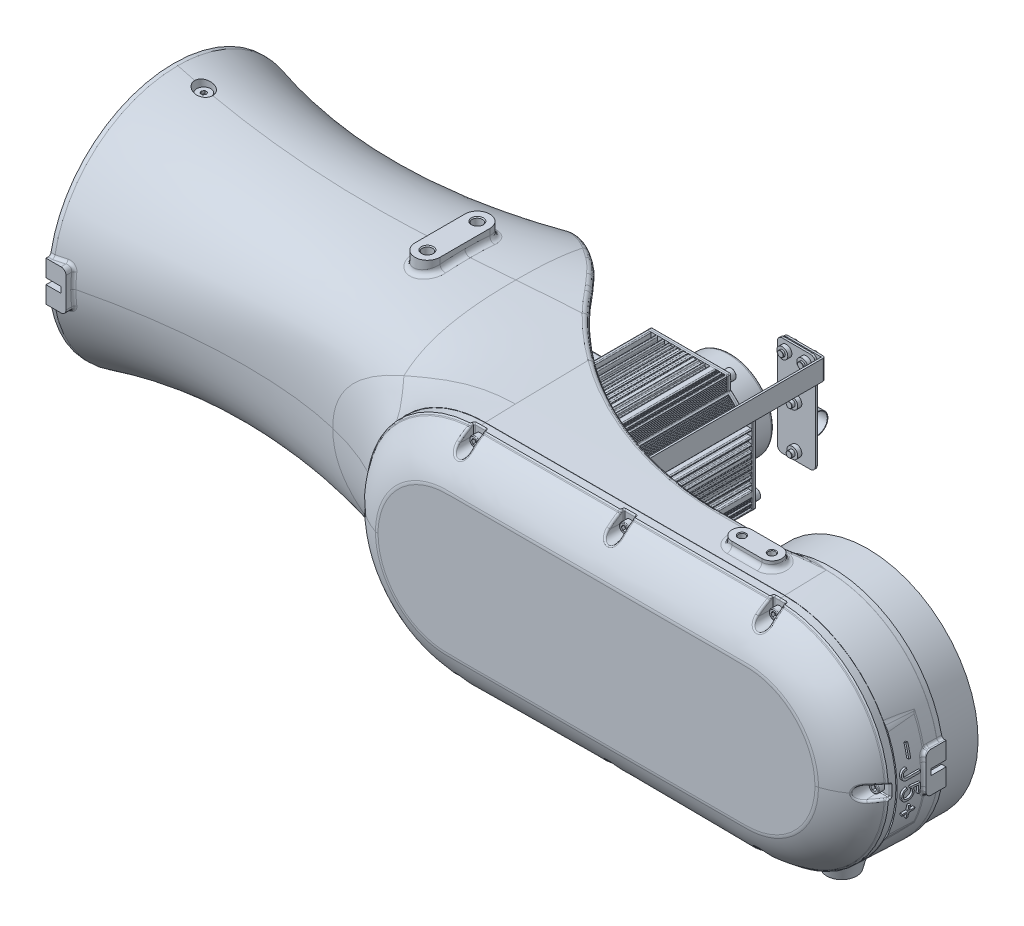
SolidWorks part; units mm, degrees
ref_plane "前视基准面" through (0, 0, 0) normal (0, 0, 1) x (1, 0, 0)
ref_plane "上视基准面" through (0, 0, 0) normal (0, 1, 0) x (1, 0, 0)
ref_plane "右视基准面" through (0, 0, 0) normal (1, 0, 0) x (0, 0, -1)
imported_body "小臂装配F-1-solid1"
sketch "草图2" plane through (0, 0, 90) normal (0, 0, -1) x (-1, 0, 0)
  line L1 (239.7684, -65.8802) -> (372.3316, -65.8802)
  line L2 (239.7684, -65.8802) -> (239.7684, 65.8802)
  line L3 (239.7684, 65.8802) -> (372.3316, 65.8802)
  line L4 (372.3316, -65.8802) -> (372.3316, 65.8802)
  line L5 (239.7684, -65.8802) -> (372.3316, 65.8802) construction
  line L6 (239.7684, 65.8802) -> (372.3316, -65.8802) construction
  point P0 (306.05, 0)
surface "曲面-基准面1" sketch "草图2"
split "分割1" trim tools "曲面-基准面1" bodies to split 122 resulting bodies 124 125
